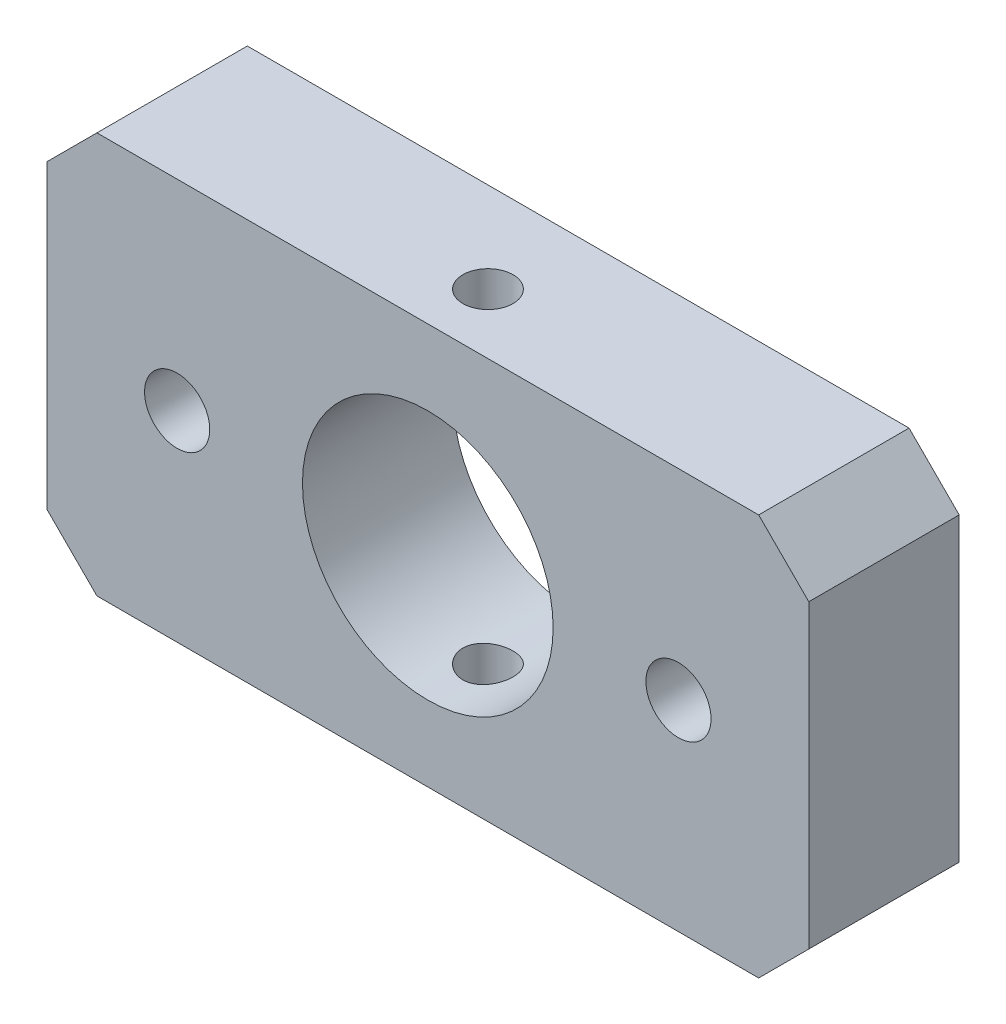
SolidWorks part; units mm, degrees
ref_plane "Plan de face" through (0, 0, 0) normal (0, 0, 1) x (1, 0, 0)
ref_plane "Plan de dessus" through (0, 0, 0) normal (0, 1, 0) x (1, 0, 0)
ref_plane "Plan de droite" through (0, 0, 0) normal (1, 0, 0) x (0, 0, -1)
sketch "Esquisse1" plane through (0, 0, 0) normal (0, 0, 1) x (1, 0, 0)
  line L1 (-38, 20) -> (38, 20)
  line L2 (-38, 20) -> (-38, -20)
  line L3 (-38, -20) -> (38, -20)
  line L4 (38, 20) -> (38, -20)
  dimension "D1" = 76
  dimension "D2" = 40
  dimension "D3" = 20
  dimension "D4" = 38
extrude "Extrusion1" add sketch "Esquisse1" along normal blind 15
sketch "Esquisse2" plane through (0, 0, 15) normal (0, 0, 1) x (1, 0, 0)
  circle A0 centre (0, 0) radius 12.5
  dimension "D1" = 25
extrude "Enlèv. mat.-Extru.1" cut sketch "Esquisse2" against normal blind 15
sketch "Esquisse3" plane through (0, 0, 15) normal (0, 0, 1) x (1, 0, 0)
  line L0 (25, 0) -> (-25, 0) construction
  circle A0 centre (25, 0) radius 3.25
  circle A1 centre (-25, 0) radius 3.25
  dimension "D1" = 6.5
  dimension "D2" = 6.5
  dimension "D3" = 25
  dimension "D4" = 25
extrude "Enlèv. mat.-Extru.2" cut sketch "Esquisse3" against normal blind 15
chamfer "Chanfrein1" distance 5 angle 45 4 edges at (38, -20, 7.5) (38, 20, 7.5) (-38, -20, 7.5) (-38, 20, 7.5)
sketch "Esquisse4" plane through (0, 20, 0) normal (0, 1, 0) x (-1, 0, 0)
  line L0 (-33, 0) -> (33, 0) construction
  line L1 (0, 9) -> (0, 0) construction
  circle A0 centre (0, 9) radius 2.5
  dimension "D1" = 5
  dimension "D2" = 9
extrude "Enlèv. mat.-Extru.3" cut sketch "Esquisse4" against normal blind 53.277
